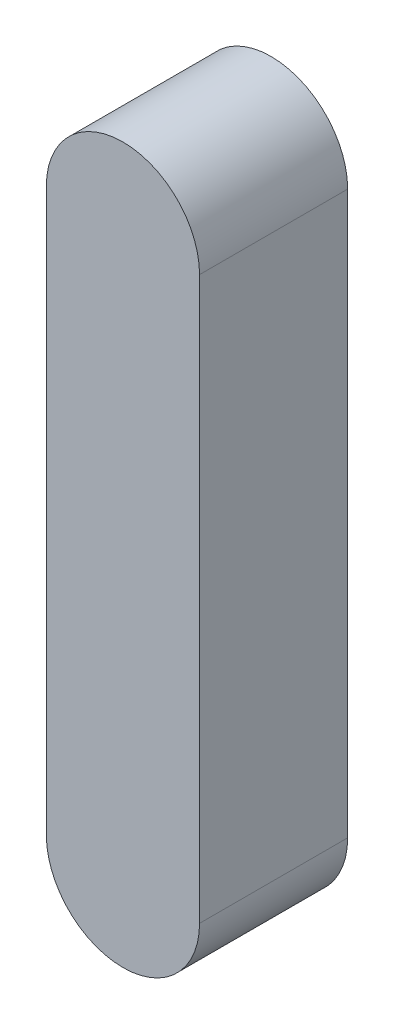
SolidWorks part; units mm, degrees
ref_plane "Plan de face" through (0, 0, 0) normal (0, 0, 1) x (1, 0, 0)
ref_plane "Plan de dessus" through (0, 0, 0) normal (0, 1, 0) x (1, 0, 0)
ref_plane "Plan de droite" through (0, 0, 0) normal (1, 0, 0) x (0, 0, -1)
sketch "Esquisse1" plane through (0, 0, 0) normal (0, 0, 1) x (1, 0, 0)
  line L2 (-7.2276, 28.566) -> (-7.2276, 17.566)
  line L4 (-4.2276, 28.566) -> (-4.2276, 17.566)
  arc A0 (-4.2276, 28.566) -> (-7.2276, 28.566) centre (-5.7276, 28.566) ccw
  arc A1 (-7.2276, 17.566) -> (-4.2276, 17.566) centre (-5.7276, 17.566) ccw
  dimension "D1" = 3
  dimension "D2" = 11
extrude "Extrusion1" add sketch "Esquisse1" along normal blind 2.9
